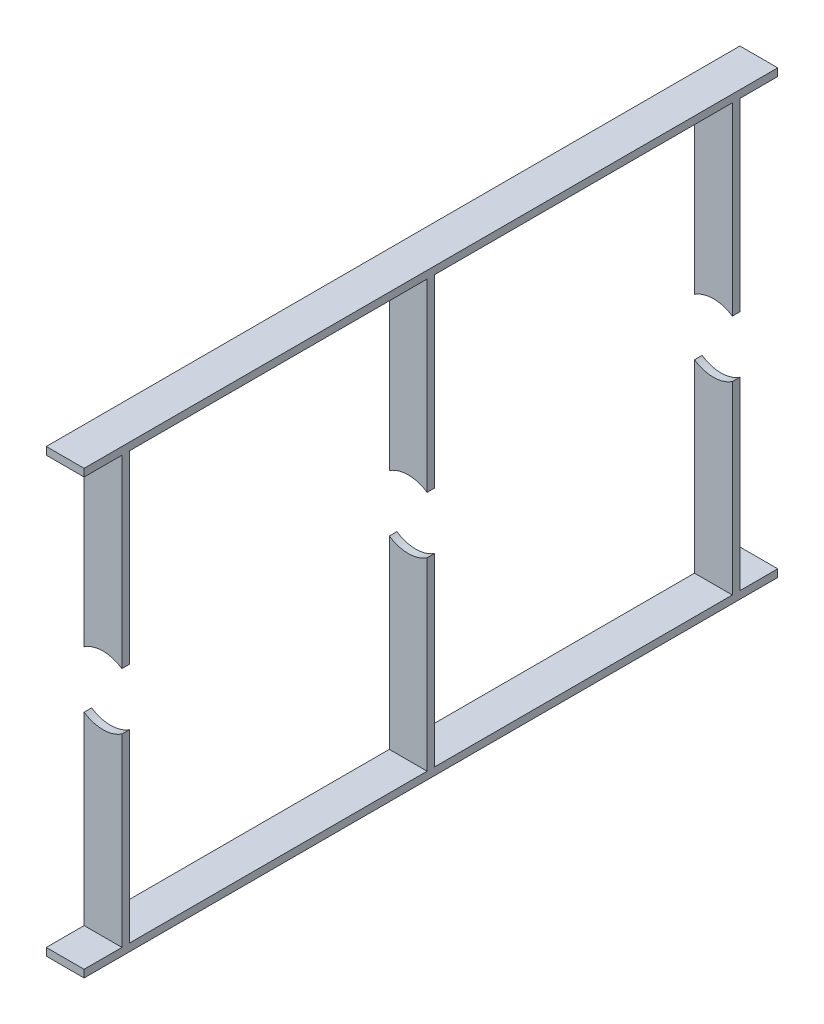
SolidWorks part; units mm, degrees
ref_plane "Front Plane" through (0, 0, 0) normal (0, 0, 1) x (1, 0, 0)
ref_plane "Top Plane" through (0, 0, 0) normal (0, 1, 0) x (1, 0, 0)
ref_plane "Right Plane" through (0, 0, 0) normal (1, 0, 0) x (0, 0, -1)
ref_plane "Plane1" through (0, 338, 0) normal (0, 1, 0) x (1, 0, 0)
sketch "Sketch3" plane through (0, 338, 0) normal (0, 1, 0) x (1, 0, 0)
  line L0 (0, -484) -> (0, 0) construction
  line L1 (30, -490) -> (-30, -490)
  line L2 (30, -490) -> (30, -478)
  line L3 (30, -478) -> (-30, -478)
  line L4 (-30, -490) -> (-30, -478)
  line L5 (30, -490) -> (-30, -478) construction
  line L6 (30, -478) -> (-30, -490) construction
  point P0 (0, -484)
  dimension "D1" = 12
  dimension "D2" = 60
  dimension "D3" = 484
extrude "Boss-Extrude3" add sketch "Sketch3" against normal blind 676
sketch "Sketch4" plane through (0, 338, 0) normal (0, 1, 0) x (1, 0, 0)
  line L0 (30, 0) -> (-30, 0) construction
  line L1 (30, -550) -> (-30, -550)
  line L2 (30, -550) -> (30, 550)
  line L3 (30, 550) -> (-30, 550)
  line L4 (-30, -550) -> (-30, 550)
  dimension "D1" = 1100
  dimension "D2" = 60
sketch "Sketch1" plane through (0, 0, 490) normal (0, 0, 1) x (1, 0, 0)
  circle A0 centre (0, 0) radius 54
  dimension "D1" = 108
extrude "Cut-Extrude1" cut sketch "Sketch1" against normal mid plane 1000 contours A0
extrude "Boss-Extrude4" add sketch "Sketch4" along normal blind 12 contours L2 L3 L4 L1
pattern_linear "LPattern1" count 3 spacing 484 along (0, 0, -1) of "Boss-Extrude3", "Cut-Extrude1"
pattern_linear "LPattern2" count 2 spacing 688 along (0, -1, 0) of "Boss-Extrude4"
